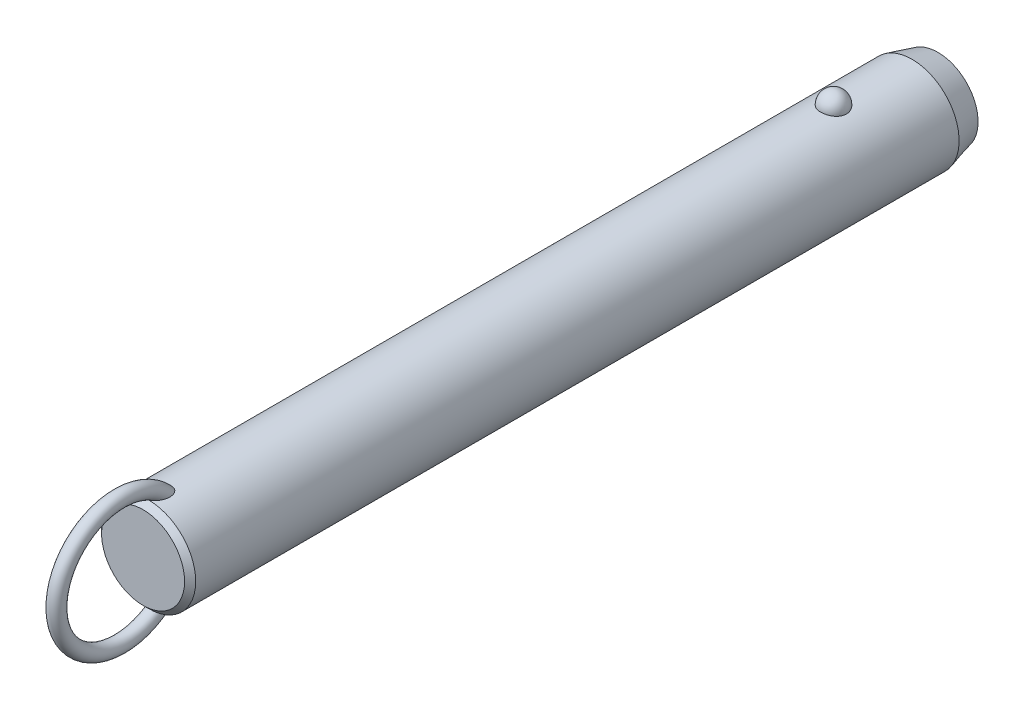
SolidWorks part; units mm, degrees
ref_plane "Front Plane" through (0, 0, 0) normal (0, 0, 1) x (1, 0, 0)
ref_plane "Top Plane" through (0, 0, 0) normal (0, 1, 0) x (1, 0, 0)
ref_plane "Right Plane" through (0, 0, 0) normal (1, 0, 0) x (0, 0, -1)
sketch "Sketch2" plane through (0, 0, 0) normal (0, 0, 1) x (1, 0, 0)
  circle A0 centre (0, 0) radius 12.7
  point P3 (0, 12.7)
  dimension "D1" = 25.4
extrude "Boss-Extrude1" add sketch "Sketch2" along normal blind 170.2
sketch "Sketch3" plane through (0, 0, 0) normal (0, 0, -1) x (-1, 0, 0)
  circle A0 centre (0, 0) radius 12.7
  dimension "D1" = 25.4
extrude "Boss-Extrude2" add sketch "Sketch3" along normal blind 31.7
chamfer "Chamfer1" distance 7 angle 15 1 edges at (-12.7, 0, -31.7)
sketch "Sketch12" plane through (0, 0, 0) normal (1, 0, 0) x (0, 0, -1)
  line L0 (-170.2, 12.7) -> (-170.2, -12.7) construction
  point P0 (-170.2, 0)
sketch "Sketch13" plane through (0, 0, 0) normal (1, 0, 0) x (0, 0, -1)
  circle A0 centre (-189.25, 0) radius 19.05
  point P2 (-170.2, 0)
  dimension "D1" = 38.1
sketch "Sketch14" plane through (0, 0, 0) normal (0, 1, 0) x (1, 0, 0)
  circle A0 centre (0, -172.2) radius 2
  point P2 (0, -170.2)
  dimension "D1" = 4
sweep "Sweep1" add profiles "Sketch14" path "Sketch13"
sketch "Sketch15" plane through (0, 0, 170.2) normal (0, 0, 1) x (1, 0, 0)
  circle A0 centre (0, 0) radius 12.7
  dimension "D1" = 25.4
extrude "Boss-Extrude3" add sketch "Sketch15" along normal blind 12.7
chamfer "Chamfer2" distance 1.5 angle 45 1 edges at (12.7, 0, 182.9)
sketch "Sketch18" plane through (0, 0, 0) normal (1, 0, 0) x (0, 0, -1)
  line L0 (24.7, 12.7) -> (-175.051, 12.7) construction
  line L1 (3.5, 16.2) -> (3.5, 9.2)
  line L2 (-175.051, -12.7) -> (24.7, -12.7) construction
  arc A0 (3.5, 16.2) -> (3.5, 9.2) centre (3.5, 12.7) ccw
  point P4 (0, 12.7)
  dimension "D1" = 28.9
revolve "Revolve1" add sketch "Sketch18" angle 360 about L1
